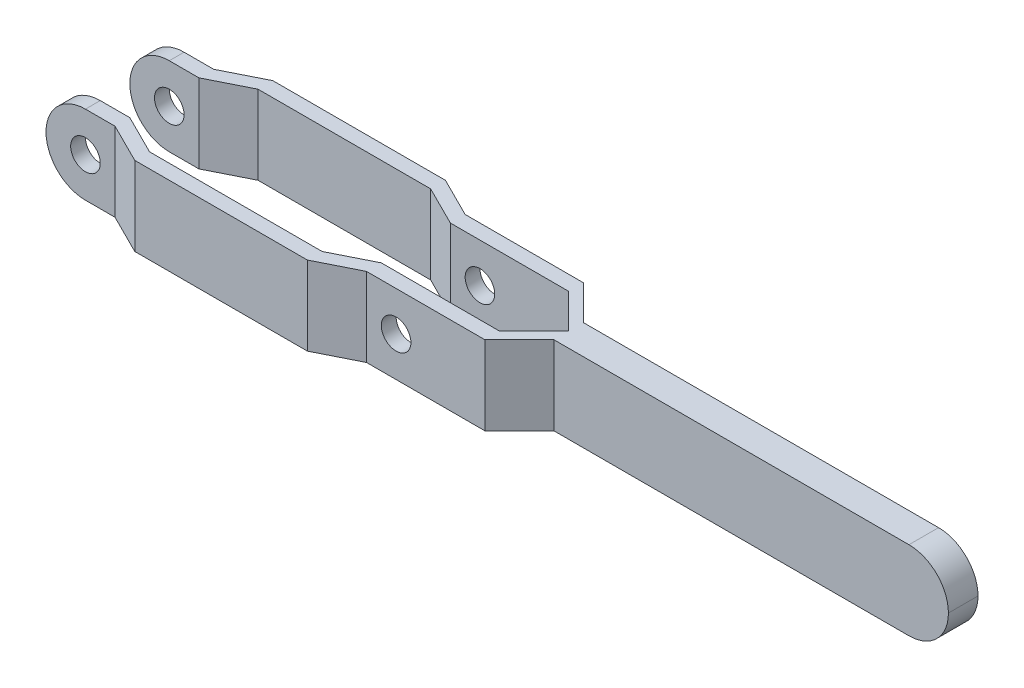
SolidWorks part; units mm, degrees
ref_plane "Front Plane" through (0, 0, 0) normal (0, 0, 1) x (1, 0, 0)
ref_plane "Top Plane" through (0, 0, 0) normal (0, 1, 0) x (1, 0, 0)
ref_plane "Right Plane" through (0, 0, 0) normal (1, 0, 0) x (0, 0, -1)
sketch "Sketch1" plane through (0, 0, 0) normal (0, 1, 0) x (1, 0, 0)
  line L0 (80, 3) -> (0, 3)
  line L1 (80, -3) -> (0, -3)
  line L2 (80, 3) -> (80, -3)
  line L3 (0, 3) -> (-7, 10)
  line L4 (0, 0) -> (-7, 7)
  line L5 (0, 0) -> (-7, -7)
  line L6 (0, -3) -> (-7, -10)
  line L7 (-7, -10) -> (-31, -10)
  line L8 (-7, -7) -> (-31, -7)
  line L9 (-7, 7) -> (-31, 7)
  line L10 (-7, 10) -> (-31, 10)
  line L11 (-31, 10) -> (-39, 14)
  line L12 (-31, 7) -> (-39, 11)
  line L13 (-39, 14) -> (-74, 14)
  line L14 (-39, 11) -> (-74, 11)
  line L15 (-31, -7) -> (-39, -11)
  line L16 (-31, -10) -> (-39, -14)
  line L17 (-39, -11) -> (-74, -11)
  line L18 (-39, -14) -> (-74, -14)
  line L19 (-74, 11) -> (-82, 7)
  line L20 (-74, 14) -> (-82, 10)
  line L21 (-74, -11) -> (-82, -7)
  line L22 (-74, -14) -> (-82, -10)
  line L23 (-82, -7) -> (-96, -7)
  line L24 (-82, -10) -> (-96, -10)
  line L25 (-82, 10) -> (-96, 10)
  line L26 (-82, 7) -> (-96, 7)
  line L27 (-96, 10) -> (-96, 7)
  line L28 (-96, -7) -> (-96, -10)
  point P7 (0, 0)
  point P29 (23.3524, 0)
  point P31 (21.8155, 0)
  point P32 (-56.5, 11)
  point P33 (-56.5, -11)
  point P34 (20.2787, 3.7613)
  point P35 (0, 0)
  point P36 (0, 0)
  point P37 (0, 0)
  point P38 (0, 0)
  point P39 (0, 0)
  point P40 (80, 0)
  point P41 (-17.6362, 256.4952)
  point P42 (0, 0)
  point P43 (0, 0)
  point P44 (-1.0666, -17.2425)
  point P45 (-3.2697, -18.4378)
  point P46 (0, 0)
  point P47 (0, 0)
  point P48 (-24.2632, 330.7146)
  point P49 (-20.9596, 268.0738)
  point P50 (-22.1825, 208.9796)
  point P51 (-10.7681, 152.1714)
  point P52 (6.0847, 27.8297)
  point P53 (0, 0)
  dimension "D2" = 8
  dimension "D3" = 80
  dimension "D4" = 96
  dimension "D5" = 8
  dimension "D6" = 14
  dimension "D7" = 14
  dimension "D8" = 24
  dimension "D9" = 8
  dimension "D10" = 35
  dimension "D11" = 22
extrude "Boss-Extrude1" add sketch "Sketch1" along normal blind 16
fillet "Fillet1" radius 8 2 edges at (80, 0, 0) (80, 16, 0)
fillet "Fillet2" radius 8 4 edges at (-96, 0, -8.5) (-96, 0, 8.5) (-96, 16, 8.5) (-96, 16, -8.5)
sketch "Sketch2" plane through (0, 0, 10) normal (0, 0, 1) x (1, 0, 0)
  circle A0 centre (-88, 8) radius 3
  circle A1 centre (-25, 8) radius 3
  dimension "D1" = 6
  dimension "D2" = 6
  dimension "D3" = 63
extrude "Cut-Extrude1" cut sketch "Sketch2" against normal through all both and the other way through all
